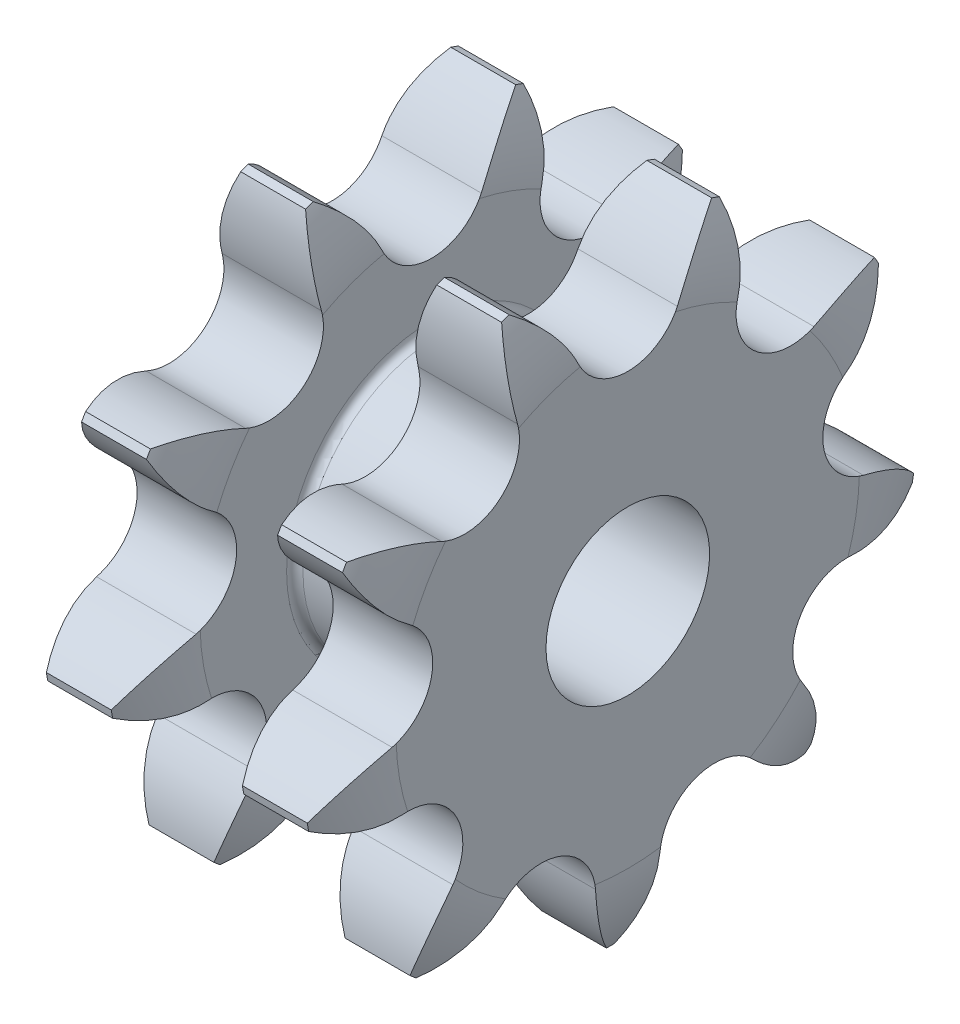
SolidWorks part; units mm, degrees
ref_plane "Plane1" through (0, 0, 0) normal (0, 0, 1) x (1, 0, 0)
ref_plane "Plane2" through (0, 0, 0) normal (0, 1, 0) x (1, 0, 0)
ref_plane "Plane3" through (0, 0, 0) normal (1, 0, 0) x (0, 0, -1)
sketch "Clipboard" plane through (0, 0, 0) normal (0, 1, 0) x (1, 0, 0)
  line L0 (0, 0) -> (12.5436, -1.9867)
  line L1 (-15, 0) -> (100, 0) construction
  line L2 (0, 0) -> (-0.8416, 0.9512)
  line L3 (0, 0) -> (-11.863, 4.5341)
  line L4 (0, 0) -> (3.0618, 0.4849)
  line L5 (0, 0) -> (-2.8109, -1.0484)
  line L6 (0, 0) -> (-17.9719, -12.1257)
  line L7 (-0.8416, 0.9512) -> (22.6002, 5.5078)
  line L8 (-76.2, 38.1) -> (-75.2, 38.1)
  line L9 (-73.4321, 41.7084) -> (-72.837, 41.7846)
  line L10 (-73.4741, 12.9512) -> (-59.0941, 12.9512)
  circle A0 centre (0, 0) radius 3.975
  circle A1 centre (0, 0) radius 10.0465
  circle A2 centre (0, 0) radius 25
sketch "BasProSke" plane through (0, 0, 0) normal (0, 1, 0) x (1, 0, 0)
  line L0 (-10, 0) -> (60, 0) construction
  line L1 (0, 0) -> (0, 16.9929)
  line L2 (0, 0) -> (21.68, 0)
  line L3 (21.68, 0) -> (21.68, 16.9929)
  line L4 (20.41, 22.5287) -> (1.27, 22.5287)
  arc A0 (0, 16.9929) -> (1.27, 22.5287) centre (12.7, 16.9929) cw
  arc A1 (21.68, 16.9929) -> (20.41, 22.5287) centre (8.98, 16.9929) ccw
revolve "Base-Revolve" add sketch "BasProSke" angle 360 about L0
sketch "GrvSke" plane through (0, 0, 0) normal (0, 1, 0) x (1, 0, 0)
  line L0 (7.3, 16.9929) -> (7.3, 10.6465)
  line L1 (7.9, 10.0465) -> (13.78, 10.0465)
  line L2 (14.38, 10.6465) -> (14.38, 16.9929)
  line L3 (6.03, 22.5287) -> (15.65, 22.5287)
  line L4 (10.84, 0) -> (10.84, 52.07) construction
  line L5 (-10, 0) -> (60, 0) construction
  line L6 (0, 0) -> (35.56, 0) construction
  arc A0 (14.38, 16.9929) -> (15.65, 22.5287) centre (27.08, 16.9929) cw
  arc A1 (7.3, 16.9929) -> (6.03, 22.5287) centre (-5.4, 16.9929) ccw
  arc A2 (7.3, 10.6465) -> (7.9, 10.0465) centre (7.9, 10.6465) ccw
  arc A3 (13.78, 10.0465) -> (14.38, 10.6465) centre (13.78, 10.6465) ccw
revolve "Groove" cut sketch "GrvSke" angle 360 about L6
sketch "TooCutSke" plane through (0, 0, 0) normal (1, 0, 0) x (0, 0, -1)
  line L0 (0, 18.6059) -> (3.6386, 16.9092) construction
  line L1 (0, 0) -> (0, 107) construction
  line L2 (0, 18.6059) -> (-10, 18.6059) construction
  line L3 (0, 18.6059) -> (-3.6386, 16.9092) construction
  arc A0 (3.6386, 16.9092) -> (7.9748, 21.6037) centre (13.1494, 12.4742) cw
  arc A1 (3.6386, 16.9092) -> (-3.6386, 16.9092) centre (0, 18.6059) cw
  arc A2 (-3.6386, 16.9092) -> (-7.9748, 21.6037) centre (-13.1494, 12.4742) ccw
  arc A3 (7.9748, 21.6037) -> (-7.9748, 21.6037) centre (0, 0) ccw
extrude "ToothCut" cut sketch "TooCutSke" along normal through all
pattern_circular "TeethCuts" count 9 every 40 about axis through (-10, 0, 0) along (1, 0, 0) of "ToothCut"
sketch "HubNeaOneSke" plane through (0, 0, 0) normal (-1, 0, 0) x (0, 0, 1)
  circle A0 centre (0, 0) radius 10.0465
extrude "HubNearOne" [suppressed] add sketch "HubNeaOneSke" along normal blind 2.2005
fillet "HubNearOneFillet" [suppressed] radius 0.6
sketch "HubNeaBotSke" plane through (0, 0, 0) normal (-1, 0, 0) x (0, 0, 1)
  circle A0 centre (0, 0) radius 10.0465
extrude "HubNearBoth" [suppressed] add sketch "HubNeaBotSke" along normal blind 1.1003
fillet "HubNearBothFillet" [suppressed] radius 0.6
ref_plane "FarPln" through (21.68, 0, 0) normal (1, 0, 0) x (0, 0, -1)
sketch "HubFarSke" plane through (21.68, 0, 0) normal (1, 0, 0) x (0, 0, -1)
  circle A0 centre (0, 0) radius 10.0465
extrude "HubFar" [suppressed] add sketch "HubFarSke" along normal blind 1.1003
fillet "HubFarFillet" [suppressed] radius 0.6
sketch "BorSke" plane through (0, 0, 0) normal (1, 0, 0) x (0, 0, -1)
  circle A0 centre (0, 0) radius 6
extrude "Bore" cut sketch "BorSke" along normal mid plane 47.761
sketch "KeySke" plane through (0, 0, 0) normal (1, 0, 0) x (0, 0, -1)
  line L0 (-1, 0) -> (-1, 7)
  line L1 (-1, 7) -> (1, 7)
  line L2 (1, 7) -> (1, 0)
  line L3 (0, 0) -> (0, 34) construction
  line L4 (-1, 0) -> (1, 0)
extrude "Keyway" [suppressed] cut sketch "KeySke" along normal mid plane 47.761
pattern_circular "Keyway2" [suppressed] count 2 every 90 about axis through (-10, 0, 0) along (1, 0, 0)
equation "\"Num_teethClipboard_v1\" =  int( \"Num_teeth@Clipboard\" )"
equation "\"Num_teethClipboard_v2\" =  ((sgn( \"Num_teethClipboard_v1\" - 5.0)+1)*( \"Num_teethClipboard_v1\" - 5.0))/2 +5.0"
equation "\"Num_teeth@Clipboard\" =  ((sgn( \"Num_teethClipboard_v2\" - 200.0)-1)*( \"Num_teethClipboard_v2\" - 200.0))/-2 +200.0"
equation "\"MHDClipboard_v1\" =  \"Pitch@Clipboard\" * (1.0 / tan(3.14159265 / \"Num_teeth@Clipboard\" )) - 1.05 * \"Plate_wid@Clipboard\" - 2.0 * \"Fillet_rad@Clipboard\" - 1.0"
equation "\"Thickness@Clipboard\" =  \"Face_width@Clipboard\" + (\"Num_strands@Clipboard\" - 1) * \"Transv_pitch@Clipboard\""
equation "\"OALClipboard_v1\" =  \"Thickness@Clipboard\" + 2 * \"Fillet_rad@Clipboard\" + 1"
equation "\"MHD@Clipboard\" =  ((sgn( \"MHDClipboard_v1\" - \"Hub_dia@Clipboard\" )-1)*( \"MHDClipboard_v1\" - \"Hub_dia@Clipboard\" ))/-2+ \"Hub_dia@Clipboard\""
equation "\"OAL@Clipboard\" =  ((sgn( \"OALClipboard_v1\" - \"Overall_len@Clipboard\" )+1)*( \"OALClipboard_v1\" - \"Overall_len@Clipboard\" ))/2 + \"Overall_len@Clipboard\" + 0.0005"
equation "\"Num_teethTeethCuts_v1\" =  int( \"Show_teeth@Clipboard\" ) + 1"
equation "\"Num_teethTeethCuts_v2\" =  ((sgn( \"Num_teethTeethCuts_v1\" - \"Num_teeth@Clipboard\" )-1)*( \"Num_teethTeethCuts_v1\" - \"Num_teeth@Clipboard\" ))/-2+ \"Num_teeth@Clipboard\""
equation "\"Num_teeth@TeethCuts\" =  ((sgn( \"Num_teethTeethCuts_v2\" - 2.0)+1)*( \"Num_teethTeethCuts_v2\" - 2.0))/2 +2.0"
equation "\"Angle@TeethCuts\" =  360.0 / \"Num_teeth@Clipboard\""
equation "\"Seat_radius@TooCutSke\" =  ( \"Pitch@Clipboard\" / 2.0) / sin(3.14159265 / \"Num_teeth@Clipboard\" ) - \"Dr@Clipboard\" / 2.0 + \"Dr@Clipboard\" * 0.505"
equation "\"R1@TooCutSke\" =  \"Dr@Clipboard\" * 0.505"
equation "\"X@TooCutSke\" =  140.0 - (90.0 / \"Num_teeth@Clipboard\")"
equation "\"R2@TooCutSke\" =  0.12 * \"Dr@Clipboard\" * ( \"Num_teeth@Clipboard\" + 2.0)"
equation "\"Overcut@TooCutSke\" =  0.5 + 0.625 * \"Pitch@Clipboard\" - 0.5 * \"Dr@Clipboard\"  +  \"Pitch@Clipboard\" / 2.0 / sin(3.14159265 / \"Num_teeth@Clipboard\" )"
equation "\"Diameter@BasProSke\" =  2.0 * ( 0.625 * \"Pitch@Clipboard\" - 0.5 * \"Dr@Clipboard\"  +  \"Pitch@Clipboard\" / 2.0 / sin(3.14159265 / \"Num_teeth@Clipboard\" ))"
equation "\"Thickness@BasProSke\" =  \"Thickness@Clipboard\""
equation "\"G1@BasProSke\" =  \"Side_relief@Clipboard\""
equation "\"G2@BasProSke\" =  \"Side_relief@Clipboard\""
equation "\"D1@BasProSke\" =  \"Side_radius@Clipboard\""
equation "\"Diameter@GrvSke\" =  \"Diameter@BasProSke\""
equation "\"G1@GrvSke\" =  \"Side_relief@Clipboard\""
equation "\"D1@GrvSke\" =  \"Side_radius@Clipboard\""
equation "\"Grv_diam@GrvSke\" =  \"Pitch@Clipboard\" * (1.0 / tan(3.14159265 / \"Num_teeth@Clipboard\" ))- 1.05 * \"Plate_wid@Clipboard\" - 2.0 * \"Fillet_rad@Clipboard\" - 1.0"
equation "\"Grv_width@GrvSke\" =  \"Transv_pitch@Clipboard\" - \"Face_width@Clipboard\""
equation "\"Offset@GrvSke\" =  \"Grv_width@GrvSke\" / 2.0 + \"Face_width@Clipboard\""
equation "\"Fillet_rad@GrvSke\" =  \"Fillet_rad@Clipboard\""
equation "\"Diameter@HubNeaOneSke\" =  \"MHD@Clipboard\""
equation "\"Length@HubNearOne\" =  \"OAL@Clipboard\" - \"Thickness@BasProSke\""
equation "\"Diameter@HubNeaBotSke\" =  \"MHD@Clipboard\""
equation "\"Length@HubNearBoth\" =  ( \"OAL@Clipboard\" - \"Thickness@BasProSke\" ) / 2.0"
equation "\"D1@HubNearOneFillet\" =  \"Fillet_rad@Clipboard\""
equation "\"D1@HubNearBothFillet\" =  \"Fillet_rad@Clipboard\""
equation "\"Thickness@FarPln\" =  \"Thickness@BasProSke\""
equation "\"Diameter@HubFarSke\" =  \"MHD@Clipboard\""
equation "\"Length@HubFar\" =  ( \"OAL@Clipboard\" - \"Thickness@BasProSke\" ) / 2.0"
equation "\"D1@HubFarFillet\" =  \"Fillet_rad@Clipboard\""
equation "\"D1@Bore\" =  \"OAL@Clipboard\" * 2.0"
equation "\"D1@Keyway\" =  \"OAL@Clipboard\" * 2.0"
equation "\"Offset@KeySke\" =  \"T_dim@Clipboard\" + \"Diameter@BorSke\" / 2.0"
